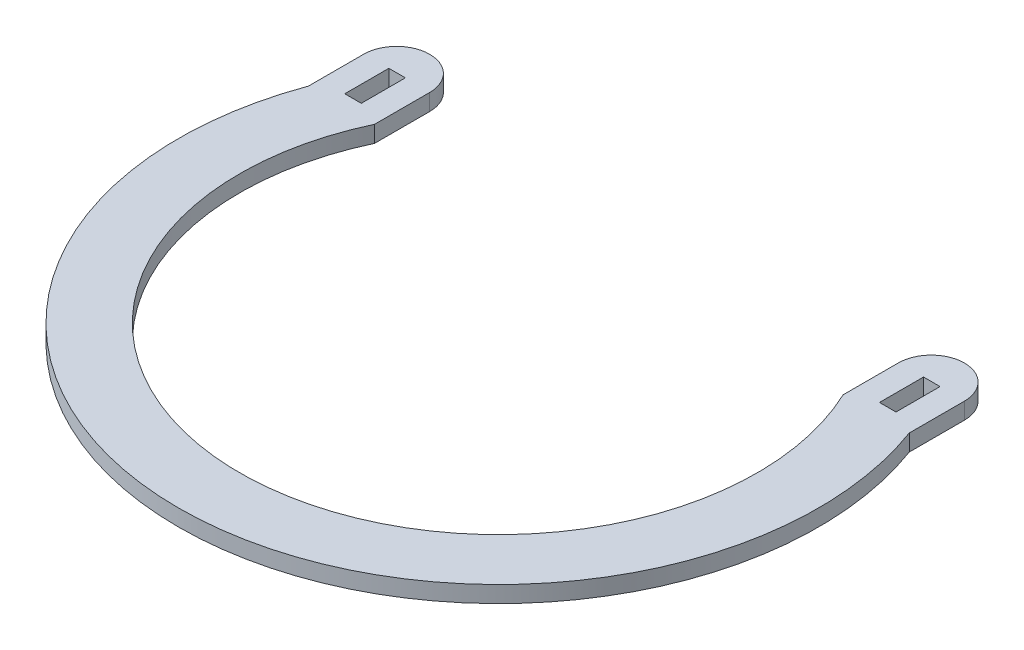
SolidWorks part; units mm, degrees
ref_plane "Plan de face" through (0, 0, 0) normal (0, 0, 1) x (1, 0, 0)
ref_plane "Plan de dessus" through (0, 0, 0) normal (0, 1, 0) x (1, 0, 0)
ref_plane "Plan de droite" through (0, 0, 0) normal (1, 0, 0) x (0, 0, -1)
sketch "Esquisse1" plane through (0, 0, 0) normal (0, 1, 0) x (1, 0, 0)
  line L2 (-54.5, 20.0131) -> (-54.5, 30.0131)
  line L4 (-42.5, 30.0131) -> (-42.5, 20.0131)
  line L8 (50, 22.1047) -> (50, 30.1047)
  line L9 (0, -61.3363) -> (0, 43.8271) construction
  line L10 (-54.5, 22.1047) -> (58.2518, 22.1047) construction
  line L11 (-47, 22.1047) -> (-50, 22.1047)
  line L12 (-47, 22.1047) -> (-47, 30.1047)
  line L13 (-47, 30.1047) -> (-50, 30.1047)
  line L14 (-50, 22.1047) -> (-50, 30.1047)
  line L15 (47, 30.1047) -> (50, 30.1047)
  line L16 (47, 22.1047) -> (47, 30.1047)
  line L17 (47, 22.1047) -> (50, 22.1047)
  line L18 (42.5, 30.0131) -> (42.5, 20.0131)
  line L19 (54.5, 20.0131) -> (54.5, 30.0131)
  arc A0 (-42.5, 20.0131) -> (42.5, 20.0131) centre (0, 0) ccw
  arc A1 (-54.5, 20.0131) -> (54.5, 20.0131) centre (0, 0) ccw
  arc A2 (-54.5, 30.0131) -> (-42.5, 30.0131) centre (-48.5, 30.0131) cw
  arc A4 (54.5, 30.0131) -> (42.5, 30.0131) centre (48.5, 30.0131) ccw
  dimension "D1" = 10
  dimension "D2" = 12
  dimension "D3" = 85
  dimension "D4" = 4.5
  dimension "D5" = 3
  dimension "D6" = 8
extrude "Boss.-Extru.1" add sketch "Esquisse1" along normal blind 3
